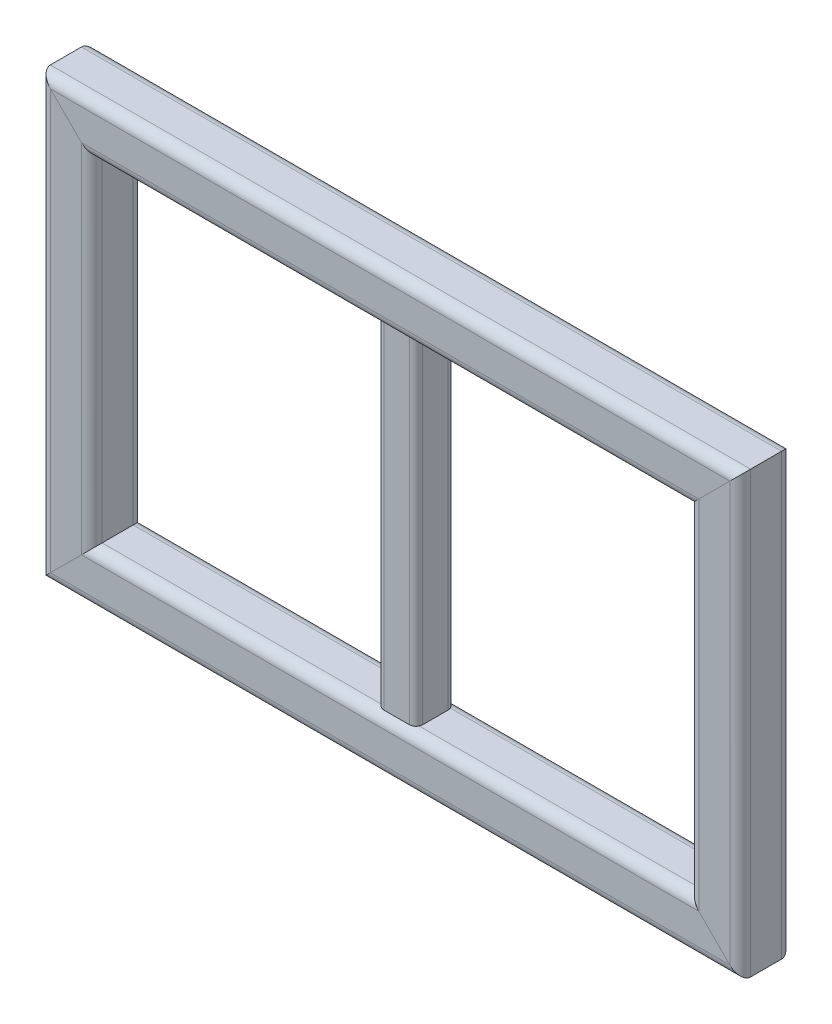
SolidWorks part; units mm, degrees
ref_plane "Płaszczyzna przednia" through (0, 0, 0) normal (0, 0, 1) x (1, 0, 0)
ref_plane "Płaszczyzna górna" through (0, 0, 0) normal (0, 1, 0) x (1, 0, 0)
ref_plane "Płaszczyzna prawa" through (0, 0, 0) normal (1, 0, 0) x (0, 0, -1)
sketch "Szkic1" plane through (0, 0, 0) normal (0, 0, 1) x (1, 0, 0)
  line L0 (0, 150) -> (0, -150)
  line L1 (250.625, -150) -> (-250.625, -150)
  line L2 (250.625, -150) -> (250.625, 150)
  line L3 (250.625, 150) -> (-250.625, 150)
  line L4 (-250.625, -150) -> (-250.625, 150)
  line L5 (250.625, -150) -> (-250.625, 150) construction
  line L6 (250.625, 150) -> (-250.625, -150) construction
  point P0 (0, 0)
  dimension "D1" = 501.25
  dimension "D2" = 300
other "Człon konstrukcyjny6"
ref_plane "Płaszczyzna6" through (-250.625, -150, 0) normal (0, 1, 0) x (-1, 0, 0)
sketch "Sketch1" plane through (-250.625, -150, 0) normal (0, 1, 0) x (-1, 0, 0)
  line L0 (-12, -16) -> (12, -16)
  line L1 (-16, -12) -> (-16, 12)
  line L2 (12, 16) -> (-12, 16)
  line L3 (16, 12) -> (16, -12)
  line L4 (-12, -20) -> (12, -20)
  line L5 (-20, -12) -> (-20, 12)
  line L6 (12, 20) -> (-12, 20)
  line L7 (20, 12) -> (20, -12)
  arc A0 (20, 12) -> (12, 20) centre (12, 12) ccw
  arc A1 (12, -20) -> (20, -12) centre (12, -12) ccw
  arc A2 (-20, -12) -> (-12, -20) centre (-12, -12) ccw
  arc A3 (-12, 20) -> (-20, 12) centre (-12, 12) ccw
  arc A4 (-12, 16) -> (-16, 12) centre (-12, 12) ccw
  arc A5 (16, 12) -> (12, 16) centre (12, 12) ccw
  arc A6 (12, -16) -> (16, -12) centre (12, -12) ccw
  arc A7 (-16, -12) -> (-12, -16) centre (-12, -12) ccw
  point P0 (-20, 0)
  point P1 (20, 0)
  point P2 (0, 20)
  point P3 (0, -20)
  point P4 (0, 0)
  point P5 (-20, -20)
  point P6 (20, -20)
  point P7 (20, 20)
  point P8 (-20, 20)
  point P33 (0, 0)
  dimension "D1" = 8
  dimension "Thickness" = 4
  dimension "V_leg" = 40
other "Człon konstrukcyjny7"
ref_plane "Płaszczyzna7" through (0, 150, 0) normal (0, -1, 0) x (1, 0, 0)
sketch "Sketch16" plane through (0, 150, 0) normal (0, -1, 0) x (1, 0, 0)
  line L0 (-9.8, -12.4) -> (9.8, -12.4)
  line L1 (-12.4, -9.8) -> (-12.4, 9.8)
  line L2 (9.8, 12.4) -> (-9.8, 12.4)
  line L3 (12.4, 9.8) -> (12.4, -9.8)
  line L4 (-9.8, -15) -> (9.8, -15)
  line L5 (-15, -9.8) -> (-15, 9.8)
  line L6 (9.8, 15) -> (-9.8, 15)
  line L7 (15, 9.8) -> (15, -9.8)
  arc A0 (15, 9.8) -> (9.8, 15) centre (9.8, 9.8) ccw
  arc A1 (9.8, -15) -> (15, -9.8) centre (9.8, -9.8) ccw
  arc A2 (-15, -9.8) -> (-9.8, -15) centre (-9.8, -9.8) ccw
  arc A3 (-9.8, 15) -> (-15, 9.8) centre (-9.8, 9.8) ccw
  arc A4 (-9.8, 12.4) -> (-12.4, 9.8) centre (-9.8, 9.8) ccw
  arc A5 (12.4, 9.8) -> (9.8, 12.4) centre (9.8, 9.8) ccw
  arc A6 (9.8, -12.4) -> (12.4, -9.8) centre (9.8, -9.8) ccw
  arc A7 (-12.4, -9.8) -> (-9.8, -12.4) centre (-9.8, -9.8) ccw
  point P0 (-15, 0)
  point P1 (15, 0)
  point P2 (0, 15)
  point P3 (0, -15)
  point P4 (0, 0)
  point P5 (-15, -15)
  point P6 (15, -15)
  point P7 (15, 15)
  point P8 (-15, 15)
  point P33 (0, 0)
  dimension "D1" = 5.2
  dimension "Thickness" = 2.6
  dimension "V_leg" = 30
other "Przytnij/Wydłuż2"
